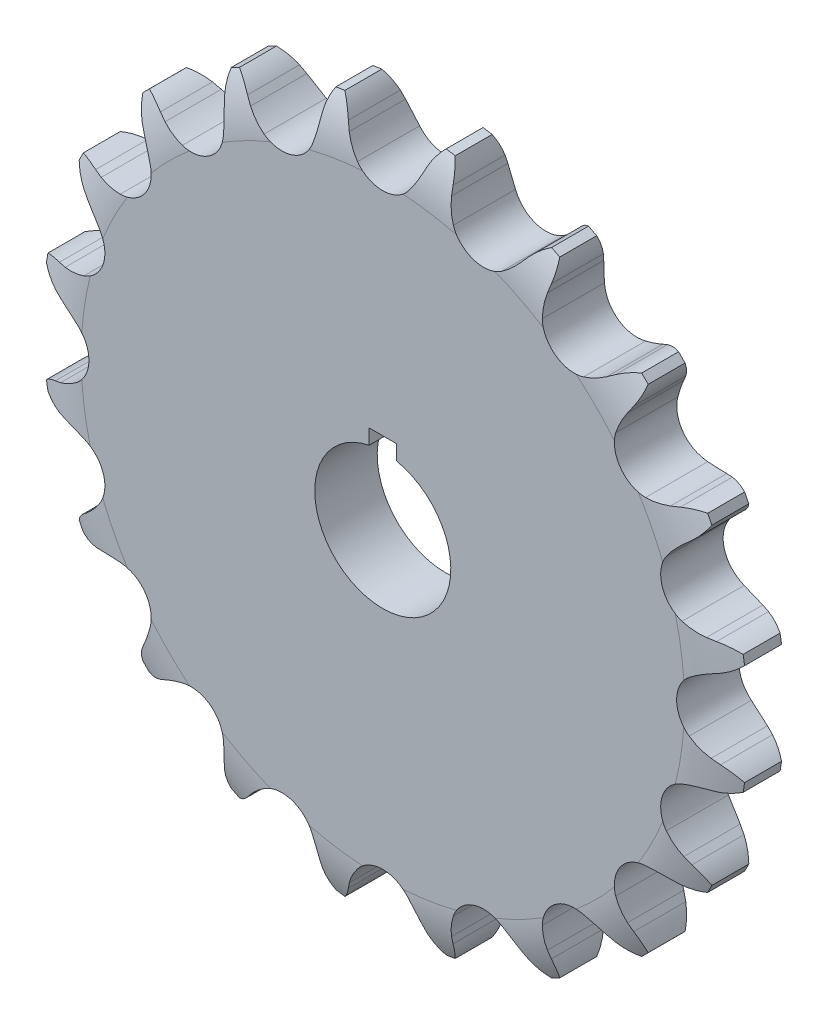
SolidWorks part; units mm, degrees
ref_plane "Front" through (0, 0, 0) normal (0, 0, 1) x (1, 0, 0)
ref_plane "Top" through (0, 0, 0) normal (0, 1, 0) x (1, 0, 0)
ref_plane "Right" through (0, 0, 0) normal (1, 0, 0) x (0, 0, -1)
sketch "Sketch1" plane through (0, 0, 0) normal (0, 0, 1) x (1, 0, 0)
  circle A0 centre (0, 0) radius 65.8535
  dimension "D1" = 131.707
extrude "Base-Extrude" add sketch "Sketch1" along normal mid plane 11.6586
sketch "Sketch3" plane through (0, 0, 0) normal (1, 0, 0) x (0, 0, -1)
  line L0 (0, 0) -> (-5.8293, 0) construction
  line L1 (-5.8293, 0) -> (5.8293, 0) construction
  line L2 (-5.8293, 65.8535) -> (-5.8293, -65.8535) construction
  line L3 (5.8293, 65.8535) -> (-5.8293, 65.8535) construction
  line L7 (-5.8293, 68.3935) -> (-5.8293, 56.3285)
  line L8 (5.8293, 67.1235) -> (-5.8293, 67.1235)
  line L9 (2.7103, 67.1235) -> (-2.7103, 67.1235)
  line L10 (5.8293, 68.3935) -> (-5.8293, 68.3935)
  line L11 (5.8293, 68.3935) -> (-5.8293, 68.3935)
  line L12 (-3.448, 65.8535) -> (-5.8293, 65.8535) construction
  line L13 (0, 68.3935) -> (0, 147.7736) construction
  line L14 (5.8293, 56.3285) -> (5.8293, 68.3935)
  arc A2 (2.7103, 67.1235) -> (5.8293, 56.3285) centre (-14.4113, 56.3285) cw
  arc A3 (-2.7103, 67.1235) -> (-5.8293, 56.3285) centre (14.4113, 56.3285) ccw
  dimension "D1" = 1.27
  dimension "D3" = 9.525
  dimension "D4" = 2.3813
  dimension "D2" = 2.54
revolve "Cut-Revolve1" cut sketch "Sketch3" angle 360 about L0
sketch "Sketch2" plane through (0, 0, -5.8293) normal (0, 0, 1) x (1, 0, 0)
  line L0 (-65.8535, 0) -> (65.8535, 0) construction
  line L1 (0, -65.8535) -> (0, 65.8535) construction
  line L2 (0, 60.8881) -> (-18.8155, 57.908) construction
  line L3 (7.4024, 62.0918) -> (6.8291, 60.7279)
  line L4 (-7.4024, 62.0918) -> (-6.8291, 60.7279)
  line L5 (16.4723, 60.8881) -> (-16.4723, 60.8881) construction
  line L6 (16.4723, 60.8881) -> (16.4723, 58.2792) construction
  line L7 (-7.5098, 66.7554) -> (-7.5098, 60.8881) construction
  line L8 (7.5098, 66.7554) -> (7.5098, 60.8881) construction
  line L9 (-16.4723, 60.8881) -> (-16.4723, 58.2792) construction
  arc A0 (-4.7471, 57.1793) -> (-6.8291, 60.7279) centre (7.5098, 66.7554) cw
  circle A1 centre (0, 0) radius 65.8535 construction
  circle A2 centre (0, 60.8881) radius 5.9563 construction
  circle A3 centre (0, 0) radius 60.8881 construction
  arc A4 (4.7471, 57.1793) -> (6.8291, 60.7279) centre (-7.5098, 66.7554) ccw
  circle A6 centre (0, 0) radius 65.8535 construction
  arc A7 (9.4515, 65.1717) -> (7.4024, 62.0918) centre (16.4723, 58.2792) ccw
  arc A8 (-4.7471, 57.1793) -> (4.7471, 57.1793) centre (0, 60.8881) ccw
  arc A9 (-9.4515, 65.1717) -> (-7.4024, 62.0918) centre (-16.4723, 58.2792) cw
  arc A10 (9.4515, 65.1717) -> (-9.4515, 65.1717) centre (0, 0) ccw
  dimension "D2" = 6.0242
  dimension "D1" = 121.7762
  dimension "D3" = 19.05
  dimension "D5" = 5.8673
  dimension "D6" = 7.5098
  dimension "D4" = 11.9126
  dimension "D9" = 9.8387
  dimension "D10" = 18.903
  dimension "D7" = 16.4723
  dimension "D8" = 2.609
  dimension "D11" = 90
extrude "Cut-Extrude2" cut sketch "Sketch2" along normal through all
pattern_circular "CirPattern1" count 20 every 18 about axis through (0, 0, 0) along (0, 0, 1) of "Cut-Extrude2"
sketch "Sketch4" plane through (0, 0, 5.8293) normal (0, 0, 1) x (1, 0, 0)
  line L0 (0, 0) -> (0, 10.521) construction
  line L2 (-2.54, 12.4434) -> (-2.54, 15.24)
  line L3 (-2.54, 15.24) -> (2.54, 15.24)
  line L4 (2.54, 12.4434) -> (2.54, 15.24)
  arc A0 (-2.54, 12.4434) -> (2.54, 12.4434) centre (0, 0) ccw
  dimension "D1" = 25.4
  dimension "D2" = 2.54
  dimension "D3" = 5.08
extrude "Cut-Extrude3" cut sketch "Sketch4" against normal through all
